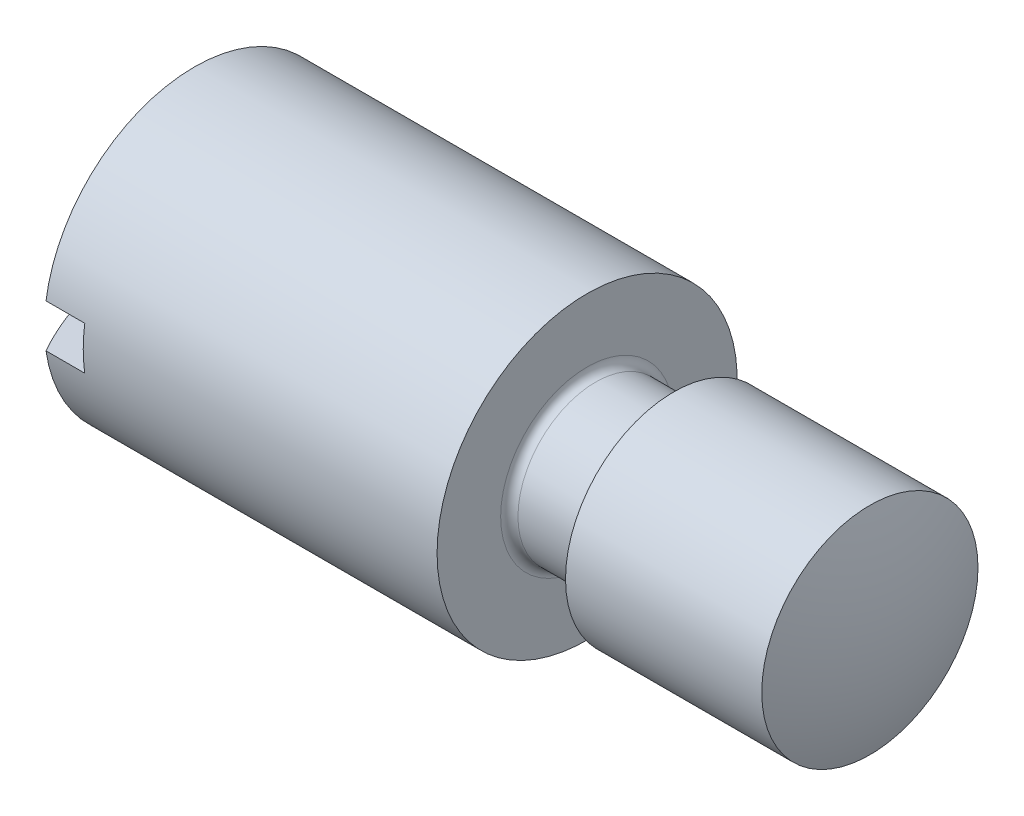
SolidWorks part; units mm, degrees
ref_plane "Front" through (0, 0, 0) normal (0, 0, 1) x (1, 0, 0)
ref_plane "Top" through (0, 0, 0) normal (0, 1, 0) x (1, 0, 0)
ref_plane "Right" through (0, 0, 0) normal (1, 0, 0) x (0, 0, -1)
sketch "Sketch1" plane through (9.9662, 0, 1.735) normal (0, 1, 0) x (1, 0, 0)
  line L0 (-1.4662, 1.735) -> (-9.9662, 1.735)
  line L1 (-3.9662, 2.985) -> (-3.9662, 2.635)
  line L2 (-1.6971, 2.985) -> (-3.9662, 2.985)
  line L3 (-4.9662, 2.635) -> (-4.9662, 3.47)
  line L4 (-4.9662, 3.47) -> (-9.5059, 3.47)
  line L5 (-14.465, 1.735) -> (1.5663, 1.735) construction
  line L6 (-3.9662, 2.635) -> (-4.9662, 2.635)
  arc A0 (-9.5059, 3.47) -> (-9.9662, 1.735) centre (-6.4662, 1.735) ccw
  arc A1 (-1.4662, 1.735) -> (-1.6971, 2.985) centre (-4.9662, 1.735) ccw
  dimension "r" = 3.5
  dimension "l" = 5
  dimension "d1" = 3.47
  dimension "b" = 3.5
  dimension "d" = 2.5
  dimension "d2" = 1.8
  dimension "a" = 1
revolve "Revolve1" add sketch "Sketch1" angle 360 about L5
sketch "Sketch2" plane through (0, 0, 0) normal (0, 0, 1) x (1, 0, 0)
  line L0 (0.4603, 1.735) -> (0.4603, -1.735) construction
  line L1 (0.9089, 0.25) -> (0.0089, 0.25)
  line L2 (0.9089, 0.25) -> (0.9089, -0.25)
  line L3 (0.9089, -0.25) -> (0.0089, -0.25)
  arc A0 (0.0089, 0.25) -> (0.0089, -0.25) centre (0.0089, 0) ccw
  arc A1 (0.4603, 1.735) -> (0.4603, -1.735) centre (3.5, 0) ccw construction
  dimension "m" = 0.25
  dimension "n" = 0.5
  dimension "t" = 0.4486
extrude "Cut-Extrude1" cut sketch "Sketch2" against normal through all and the other way through all
fillet "Fillet2" radius 0.1 2 edges at (6, 0, 0.9) (5, 0, 0.9)
sketch "Sketch3" plane through (0, 0, 0) normal (0, 1, 0) x (1, 0, 0)
  line L0 (8.2692, 0.9794) -> (8.4254, 1.25)
  line L1 (8.4254, 1.25) -> (8.4254, 1.5625)
  line L2 (8.4254, 1.5625) -> (8.1129, 1.5625)
  line L3 (8.1129, 1.5625) -> (8.1129, 1.25)
  line L4 (8.1129, 1.25) -> (8.2692, 0.9794)
  line L5 (8.2692, 1.25) -> (8.2692, -1.25) construction
  line L7 (0, 0) -> (10.589, 0) construction
  line L8 (8.2692, 1.25) -> (6, 1.25) construction
  dimension "D1" = 0.3125
revolve "Cut-Revolve10" [suppressed] cut sketch "Sketch3" angle 360 about L7
pattern_linear "LPattern10" [suppressed] count 7 spacing 0.375 along (1, 0, 0)
equation "\"m@Sketch2\" = \"n@Sketch2\" / 2"
equation "\"D1@Sketch3\" =  ( \"d@Sketch1\" - \"D2@ThreadCosmetic1\" )  / 2"
equation "\"D3@LPattern10\" = \"D1@Sketch3\" * 1.2"
equation "\"D1@LPattern10\" =  ( \"b@Sketch1\" - \"a@Sketch1\" )  / \"D3@LPattern10\""
